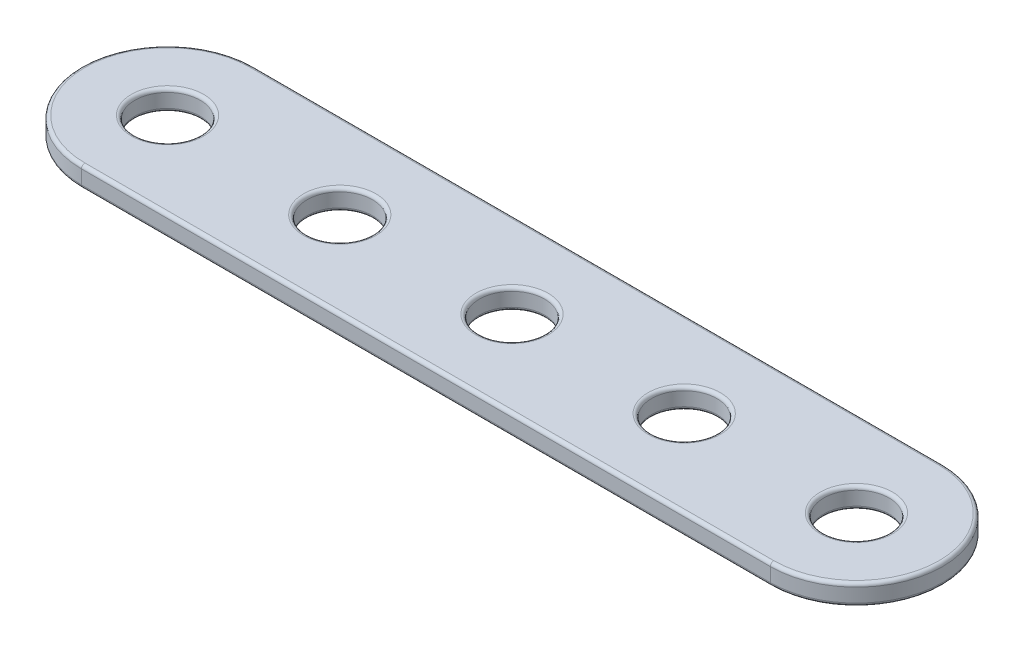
SolidWorks part; units mm, degrees
ref_plane "Front" through (0, 0, 0) normal (0, 0, 1) x (1, 0, 0)
ref_plane "Top" through (0, 0, 0) normal (0, 1, 0) x (1, 0, 0)
ref_plane "Right" through (0, 0, 0) normal (1, 0, 0) x (0, 0, -1)
sketch "Sketch1" plane through (0, 0, 0) normal (0, 1, 0) x (1, 0, 0)
  line L1 (0, 0) -> (50.8, 0)
  line L3 (0, 12.7) -> (50.8, 12.7)
  arc A0 (0, 12.7) -> (0, 0) centre (0, 6.35) ccw
  arc A1 (50.8, 0) -> (50.8, 12.7) centre (50.8, 6.35) ccw
  dimension "D1" = 12.7
  dimension "D2" = 50.8
extrude "Extrude1" add sketch "Sketch1" along normal blind 1.524
sketch "Sketch2" plane through (0, 1.524, 0) normal (0, 1, 0) x (-1, 0, 0)
  line L0 (-50.8, -12.7) -> (0, -12.7) construction
  circle A0 centre (0, -6.35) radius 2.413
  dimension "D2" = 4.826
  dimension "D1" = 6.35
extrude "Cut-Extrude1" cut sketch "Sketch2" against normal through all
pattern_linear "LPattern1" count 5 spacing 12.7 along (1, 0, 0) of "Cut-Extrude1"
fillet "Fillet1" radius 0.254 18 edges at (57.15, 1.524, -6.35) (25.4, 1.524, -12.7) (0, 0, -3.937) (0, 1.524, -3.937) (12.7, 0, -3.937) (12.7, 1.524, -3.937) (25.4, 0, -3.937) (25.4, 1.524, -3.937) (38.1, 0, -3.937) (38.1, 1.524, -3.937) (50.8, 0, -3.937) (50.8, 1.524, -3.937) (-6.35, 1.524, -6.35) (25.4, 0, -12.7) (57.15, 0, -6.35) (25.4, 0, 0) (-6.35, 0, -6.35) (25.4, 1.524, 0)
equation "\"D2@Sketch1\" = \"D3@LPattern1\" *  ( \"D1@LPattern1\" - 1 ) "
